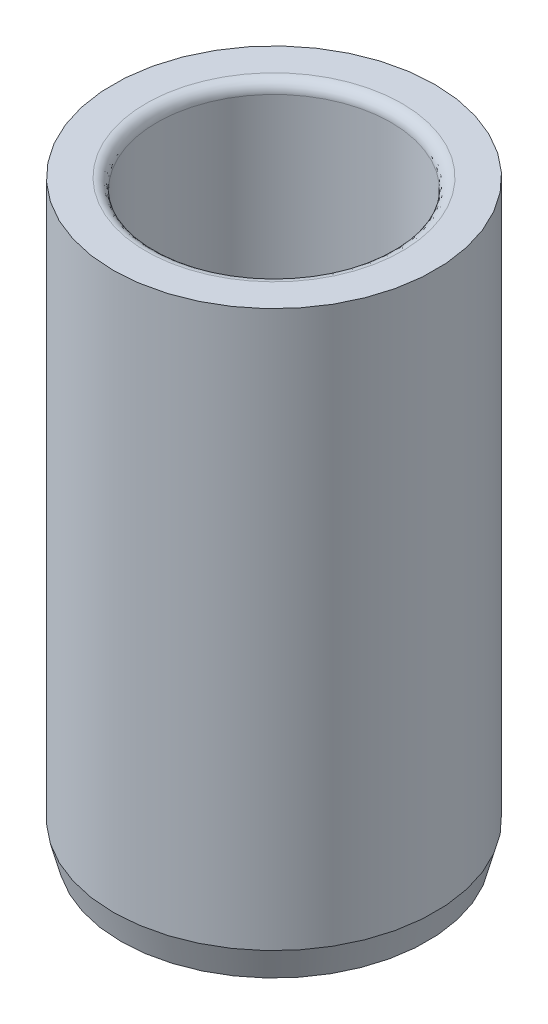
SolidWorks part; units mm, degrees
ref_plane "Plan de face" through (0, 0, 0) normal (0, 0, 1) x (1, 0, 0)
ref_plane "Plan de dessus" through (0, 0, 0) normal (0, 1, 0) x (1, 0, 0)
ref_plane "Plan de droite" through (0, 0, 0) normal (1, 0, 0) x (0, 0, -1)
sketch "Esquisse1" plane through (0, 0, 0) normal (0, 0, 1) x (1, 0, 0)
  line L1 (5.5, 0) -> (6.4641, 0)
  line L2 (0, 0) -> (0, 20) construction
  line L3 (5.5, 20) -> (7, 20)
  line L5 (7, 20) -> (7, 2)
  line L6 (5, 0.5) -> (5, 19.5)
  line L7 (6.4641, 0) -> (7, 2)
  arc A1 (5.5, 20) -> (5, 19.5) centre (5.5, 19.5) ccw
  arc A2 (5.5, 0) -> (5, 0.5) centre (5.5, 0.5) cw
  dimension "r1" = 0.5
  dimension "d1" = 10
  dimension "ch" = 15
  dimension "d2" = 14
  dimension "l4" = 2
  dimension "l1" = 20
revolve "Révolution1" add sketch "Esquisse1" angle 360 about L2
